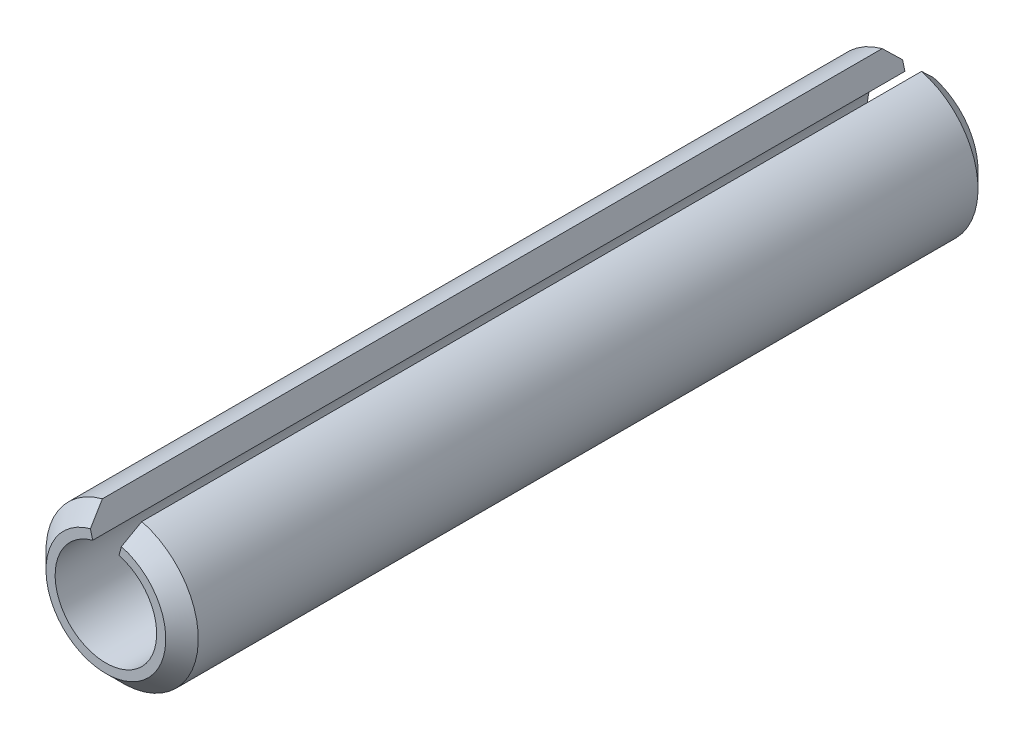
SolidWorks part; units mm, degrees
ref_plane "Front Plane" through (0, 0, 0) normal (0, 0, 1) x (1, 0, 0)
ref_plane "Top Plane" through (0, 0, 0) normal (0, 1, 0) x (1, 0, 0)
ref_plane "Right Plane" through (0, 0, 0) normal (1, 0, 0) x (0, 0, -1)
sketch "Sketch1" plane through (0, 0, 0) normal (0, 0, 1) x (1, 0, 0)
  line L0 (0.2054, 0.7667) -> (0.3082, 1.1501)
  line L1 (-0.2054, 0.7667) -> (-0.3082, 1.1501)
  line L2 (0, 0) -> (0, 2.5064) construction
  arc A0 (-0.3082, 1.1501) -> (0.3082, 1.1501) centre (0, 0) ccw
  arc A1 (-0.2054, 0.7667) -> (0.2054, 0.7667) centre (0, 0) ccw
  dimension "D1" = 2.3813
  dimension "D2" = 1.5875
  dimension "D3" = 30
extrude "Extrude1" add sketch "Sketch1" along normal mid plane 12.7
chamfer "Chamfer1" distance 0.254 angle 45 2 edges at (0, -1.1906, -6.35) (0, -1.1906, 6.35)
